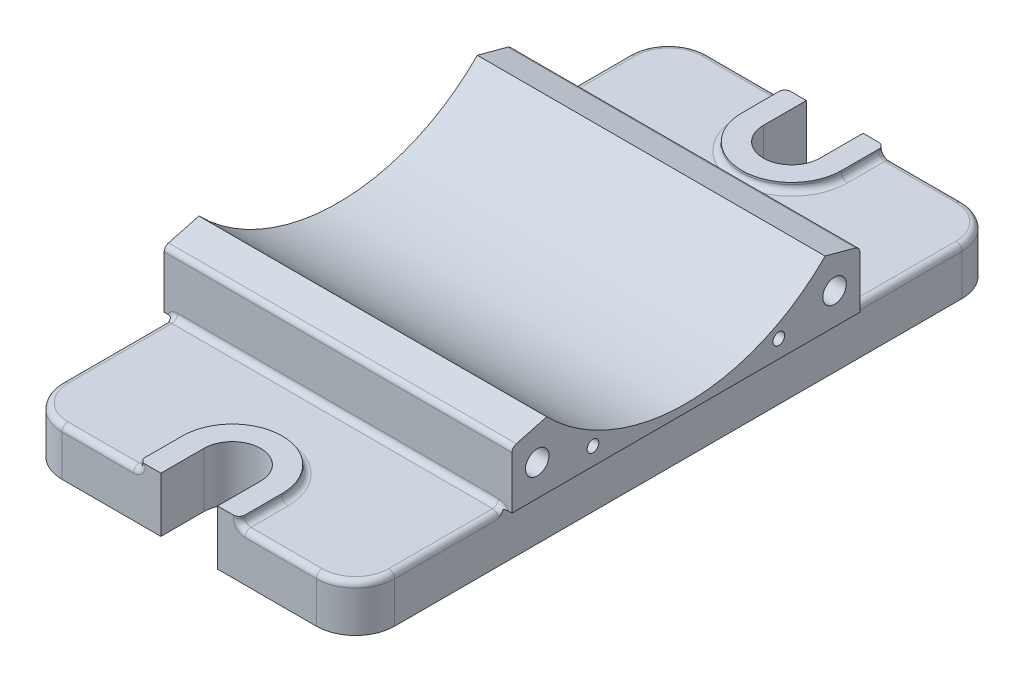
SolidWorks part; units mm, degrees
ref_plane "Front Plane" through (0, 0, 0) normal (0, 0, 1) x (1, 0, 0)
ref_plane "Top Plane" through (0, 0, 0) normal (0, 1, 0) x (1, 0, 0)
ref_plane "Right Plane" through (0, 0, 0) normal (1, 0, 0) x (0, 0, -1)
sketch "Sketch1" plane through (0, 0, 0) normal (0, 1, 0) x (1, 0, 0)
  line L0 (0, 39.3168) -> (0, -29.6222) construction
  line L1 (-42.5, 82.5) -> (42.5, 82.5)
  line L2 (-42.5, 82.5) -> (-42.5, -82.5)
  line L3 (-42.5, -82.5) -> (42.5, -82.5)
  line L4 (42.5, 82.5) -> (42.5, -82.5)
  line L5 (-24.4159, 0) -> (20.4663, 0) construction
  dimension "D1" = 165
  dimension "D2" = 85
extrude "Boss-Extrude1" add sketch "Sketch1" along normal blind 12
sketch "Sketch2" plane through (0, 0, 0) normal (1, 0, 0) x (0, 0, -1)
  line L0 (-44.45, 12) -> (44.45, 12)
  line L1 (-82.5, 12) -> (82.5, 12) construction
  line L2 (44.45, 12) -> (44.45, 26.5)
  line L3 (44.45, 26.5) -> (35.5846, 28.8755)
  line L4 (-44.45, 12) -> (-44.45, 26.5)
  line L5 (-44.45, 26.5) -> (-35.5846, 28.8755)
  line L6 (0, 0) -> (0, 59.3729) construction
  arc A0 (-35.5846, 28.8755) -> (35.5846, 28.8755) centre (0, 64) ccw
  dimension "D4" = 50
  dimension "D1" = 88.9
  dimension "D2" = 14.5
  dimension "D3" = 75
  dimension "D5" = 52
extrude "Boss-Extrude2" add sketch "Sketch2" along normal mid plane 88.9
sketch "Sketch3" plane through (0, 12, 0) normal (0, 1, 0) x (1, 0, 0)
  line L0 (0, 0) -> (0, -102.0462) construction
  line L1 (-42.5, -82.5) -> (42.5, -82.5) construction
  line L2 (-7.25, -82.5) -> (7.25, -82.5)
  line L3 (-7.25, -82.5) -> (-7.25, -71.5)
  line L5 (7.25, -82.5) -> (7.25, -71.5)
  arc A0 (-7.25, -71.5) -> (7.25, -71.5) centre (0, -71.5) cw
  dimension "D2" = 11
  dimension "D1" = 14.5
extrude "Cut-Extrude1" cut sketch "Sketch3" against normal up to next
sketch "Sketch4" plane through (0, 12, 0) normal (0, 1, 0) x (1, 0, 0)
  line L0 (-7.25, -71.5) -> (-7.25, -82.5) construction
  line L1 (7.25, -82.5) -> (7.25, -71.5) construction
  line L2 (-7.25, -71.5) -> (-7.25, -82.5)
  line L3 (7.25, -82.5) -> (7.25, -71.5)
  line L4 (12.75, -82.5) -> (12.75, -71.5)
  line L5 (-12.75, -71.5) -> (-12.75, -82.5)
  line L6 (-12.75, -82.5) -> (-7.25, -82.5)
  line L7 (7.25, -82.5) -> (12.75, -82.5)
  arc A0 (7.25, -71.5) -> (-7.25, -71.5) centre (0, -71.5) ccw construction
  arc A1 (7.25, -71.5) -> (-7.25, -71.5) centre (0, -71.5) ccw
  arc A2 (12.75, -71.5) -> (-12.75, -71.5) centre (0, -71.5) ccw
  dimension "D1" = 5.5
extrude "Boss-Extrude3" add sketch "Sketch4" along normal blind 2
mirror "Mirror1" about plane through (0, 0, 0) normal (0, 0, 1) of "Cut-Extrude1", "Boss-Extrude3"
hole_wizard "M7x1.0 Tapped Hole1" positions "Sketch6" profile "Sketch5" tap size "M7x1.0" standard "ANSI Metric"
sketch "Sketch6" plane through (44.45, 0, 0) normal (1, 0, 0) x (0, 0, -1)
  line L0 (-82.5, 0) -> (82.5, 0) construction
  point P0 (-38, 20)
  dimension "D1" = 38
  dimension "D2" = 20
sketch "Sketch5" plane through (44.45, 20, 38) normal (0, 1, 0) x (0, 0, -1)
  line L0 (0, 0) -> (0, 20.8026)
  line L1 (0, 20.8026) -> (3, 19)
  line L2 (3, 19) -> (3, 0)
  line L5 (3, 0) -> (0, 0)
  line L10 (0, 20.8026) -> (-3, 19) construction
  line L11 (0, -6.35) -> (0, 107.95) construction
  dimension "Tap Drill Dia." = 6
  dimension "Tap Drill Depth" = 19
  dimension "Drill Angle" = 118
other "Hole1" parameters "D1"=14.5
sketch "Sketch9" plane through (44.45, 0, 0) normal (1, 0, 0) x (0, 0, -1)
  line L0 (-44.45, 25.349) -> (-44.45, 12) construction
  circle A0 centre (-23.75, 16.5) radius 1.5
  circle A1 centre (-38, 20) radius 3 construction
  dimension "D1" = 3
  dimension "D2" = 20.7
  dimension "D3" = 3.5
mirror "Mirror2" about plane through (0, 0, 0) normal (0, 0, 1) of "M7x1.0 Tapped Hole1"
fillet "Fillet1" radius 10 4 edges at (-42.5, 6, -82.5) (42.5, 6, -82.5) (42.5, 6, 82.5) (-42.5, 6, 82.5)
fillet "Fillet2" radius 1.5 24 edges at (-12.75, 13, -82.5) (12.75, 13, -82.5) (-12.75, 13, 82.5) (12.75, 13, 82.5) (-12.75, 12, -77) (0, 12, -58.75) (-42.5, 12, -58.475) (-39.5711, 12, -79.5711) (22.625, 12, -82.5) (39.5711, 12, -79.5711) (-42.5, 12, 58.475) (-39.5711, 12, 79.5711) (-12.75, 12, 77) (0, 12, 58.75) (22.625, 12, 82.5) (39.5711, 12, 79.5711) (0, 26.5, -44.45) (0, 26.5, 44.45) (12.75, 12, -77) (-22.625, 12, -82.5) (42.5, 12, -58.475) (-22.625, 12, 82.5) (12.75, 12, 77) (42.5, 12, 58.475)
fillet "Fillet3" radius 1.5 6 edges at (42.0607, 11.5607, 44.45) (-42.0607, 11.5607, 44.45) (42.0607, 11.5607, -44.45) (-42.0607, 11.5607, -44.45) (0, 12, 44.45) (0, 12, -44.45)
mirror "Mirror3" about plane through (0, 0, 0) normal (1, 0, 0) of "Mirror2", "M7x1.0 Tapped Hole1"
mirror "Mirror4" about plane through (0, 0, 0) normal (0, 0, 1) of "Hole1"
mirror "Mirror5" about plane through (0, 0, 0) normal (1, 0, 0) of "Mirror4", "Hole1"
